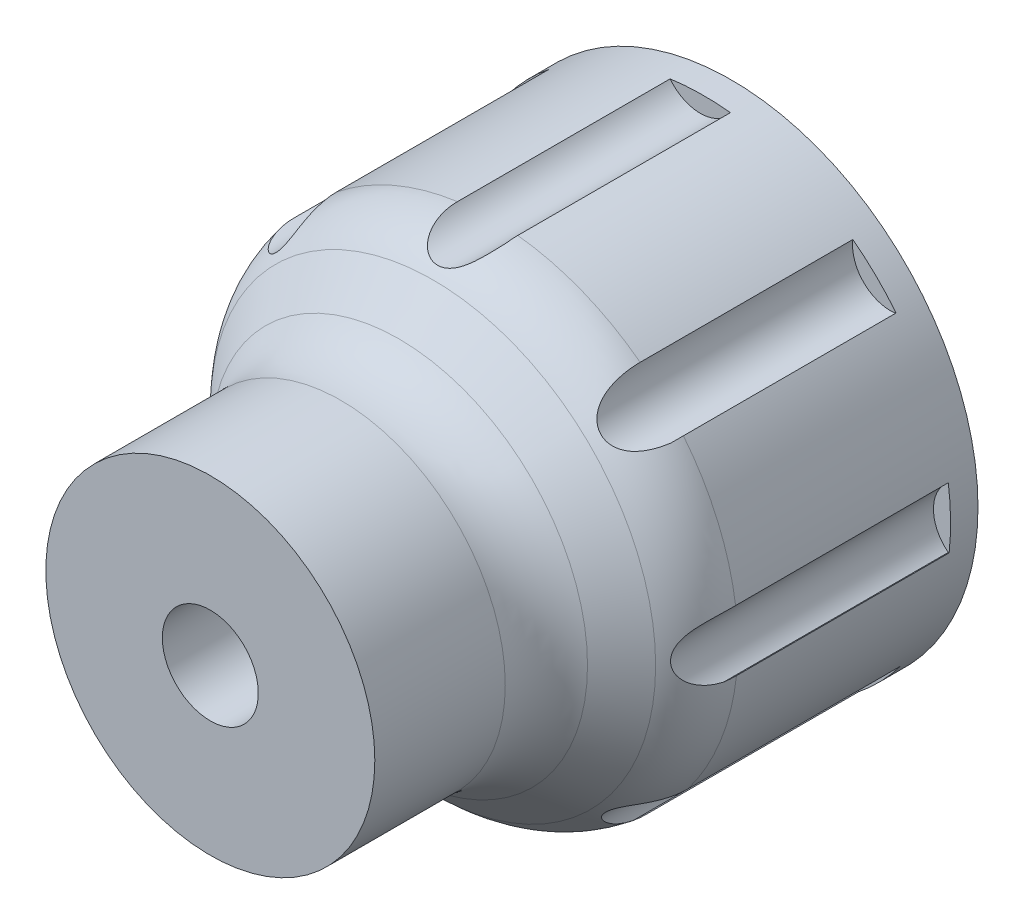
SolidWorks part; units mm, degrees
ref_plane "Plan1" through (0, 0, 0) normal (0, 0, 1) x (1, 0, 0)
ref_plane "Plan2" through (0, 0, 0) normal (0, 1, 0) x (1, 0, 0)
ref_plane "Plan3" through (0, 0, 0) normal (1, 0, 0) x (0, 0, -1)
sketch "Esquisse1" plane through (0, 0, 0) normal (0, 0, 1) x (1, 0, 0)
  circle A0 centre (0, 0) radius 9
  dimension "D1" = 18
extrude "Base-Extrusion" add sketch "Esquisse1" along normal blind 10
sketch "Esquisse2" plane through (0, 0, 10) normal (0, 0, 1) x (1, 0, 0)
  circle A0 centre (0, 0) radius 6
  dimension "D1" = 12
extrude "Boss.-Extru.1" add sketch "Esquisse2" along normal blind 9
chamfer "Chanfrein1" distance 3 angle 45 1 edges at (6, 0, 10)
fillet "Congé1" radius 3 2 edges at (9, 0, 10) (6, 0, 13)
sketch "Esquisse3" plane through (0, 0, 0) normal (0, 0, -1) x (-1, 0, 0)
  circle A0 centre (0, 0) radius 1.75
  dimension "D1" = 3.5
extrude "Enlèv. mat.-Extru.1" cut sketch "Esquisse3" against normal through all
sketch "Esquisse4" plane through (0, 0, 0) normal (0, 0, -1) x (-1, 0, 0)
  circle A0 centre (0, 0) radius 4
  circle A1 centre (0, 0) radius 8
  dimension "D1" = 8
  dimension "D2" = 16
extrude "Enlèv. mat.-Extru.2" cut sketch "Esquisse4" against normal blind 9
sketch "Esquisse5" plane through (0, 0, 9) normal (0, 0, -1) x (-1, 0, 0)
  line L1 (0.5, -3.9686) -> (-0.5, -3.9686)
  line L2 (0.5, -3.9686) -> (0.5, -8.9861)
  line L3 (0.5, -8.9861) -> (-0.5, -8.9861)
  line L4 (-0.5, -3.9686) -> (-0.5, -8.9861)
  circle A2 centre (0, 0) radius 4 construction
  circle A3 centre (0, 0) radius 9 construction
  dimension "D1" = 1
  dimension "D2" = 0.5
extrude "Boss.-Extru.2" add sketch "Esquisse5" along normal blind 5
pattern_circular "Répétition circulaire1" count 8 every 45 about axis through (0, 0, 0) along (0, 0, 1) of "Boss.-Extru.2"
ref_plane "Plan4" through (0, 0, 1) normal (0, 0, 1) x (1, 0, 0)
sketch "Esquisse6" plane through (0, 0, 1) normal (0, 0, 1) x (1, 0, 0)
  line L0 (0.9703, 8.9157) -> (0.9703, 9.7629)
  line L1 (0.9703, 9.7629) -> (-1.2291, 9.7629)
  line L2 (-1.2291, 9.7629) -> (-1.2291, 8.9157)
  arc A0 (-1.2291, 8.9157) -> (0.9703, 8.9157) centre (-0.1294, 9.7629) ccw
  circle A1 centre (0, 0) radius 9 construction
extrude "Enlèv. mat.-Extru.3" cut sketch "Esquisse6" along normal through all
pattern_circular "Répétition circulaire2" count 8 every 45 about axis through (0, 0, 0) along (0, 0, 1) of "Enlèv. mat.-Extru.3"
